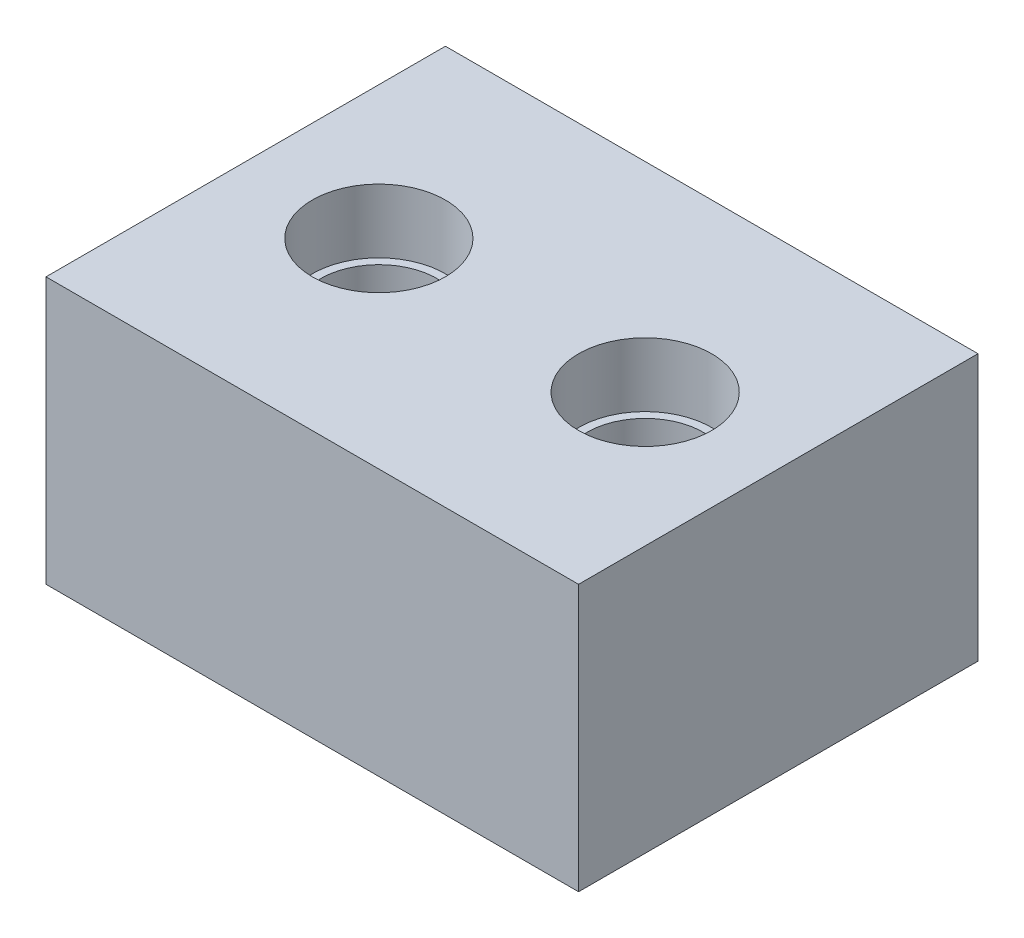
SolidWorks part; units mm, degrees
ref_plane "Front" through (0, 0, 0) normal (0, 0, 1) x (1, 0, 0)
ref_plane "Top" through (0, 0, 0) normal (0, 1, 0) x (1, 0, 0)
ref_plane "Right" through (0, 0, 0) normal (1, 0, 0) x (0, 0, -1)
sketch "Sketch1" plane through (0, 0, 0) normal (0, 1, 0) x (1, 0, 0)
  line L1 (-25.4, -19.05) -> (25.4, -19.05)
  line L2 (-25.4, -19.05) -> (-25.4, 19.05)
  line L3 (-25.4, 19.05) -> (25.4, 19.05)
  line L4 (25.4, -19.05) -> (25.4, 19.05)
  line L5 (-25.4, -19.05) -> (25.4, 19.05) construction
  line L6 (-25.4, 19.05) -> (25.4, -19.05) construction
  point P0 (0, 0)
  dimension "D1" = 50.8
  dimension "D2" = 38.1
extrude "Boss-Extrude1" add sketch "Sketch1" along normal blind 25.4
sketch "Sketch2" plane through (0, 25.4, 0) normal (0, 1, 0) x (1, 0, 0)
  line L0 (-25.4, 0) -> (25.4, 0) construction
  line L1 (-25.4, 19.05) -> (-25.4, -19.05) construction
  line L2 (25.4, -19.05) -> (25.4, 19.05) construction
  line L3 (-12.7, -19.05) -> (-12.7, 19.05) construction
  line L4 (-25.4, -19.05) -> (25.4, -19.05) construction
  line L5 (25.4, 19.05) -> (-25.4, 19.05) construction
  line L6 (0, -19.05) -> (0, 19.05) construction
  line L7 (12.7, -19.05) -> (12.7, 19.05) construction
  circle A0 centre (-12.7, 0) radius 6.35
  circle A1 centre (12.7, 0) radius 6.35
  dimension "D3" = 12.7
  dimension "D4" = 12.7
  dimension "D1" = 12.7
  dimension "D2" = 12.7
extrude "Cut-Extrude1" cut sketch "Sketch2" against normal blind 6.096
hole_wizard "CBORE for 1/4 Socket Head Cap Screw1" positions "Sketch3" profile "Sketch4" counterbore size "1/4" standard "ANSI Inch"
sketch "Sketch3" plane through (0, 19.304, 0) normal (0, 1, 0) x (1, 0, 0)
  point P0 (-12.7, 0)
  point P3 (12.7, 0)
sketch "Sketch4" plane through (-12.7, 19.304, 0) normal (1, 0, 0) x (0, 0, 1)
  line L0 (0, 0) -> (0, 19.304)
  line L1 (0, 19.304) -> (3.5712, 19.304)
  line L3 (3.5712, 19.304) -> (3.5712, 6.35)
  line L4 (3.5712, 6.35) -> (5.5562, 6.35)
  line L5 (5.5562, 6.35) -> (5.5562, 0)
  line L7 (5.5562, 0) -> (0, 0)
  line L11 (0, -6.35) -> (0, 107.95) construction
  dimension "Thru Hole Dia." = 7.1425
  dimension "Thru Hole Depth" = 19.304
  dimension "C'Bore Dia." = 11.1125
  dimension "C'Bore Depth" = 6.35
